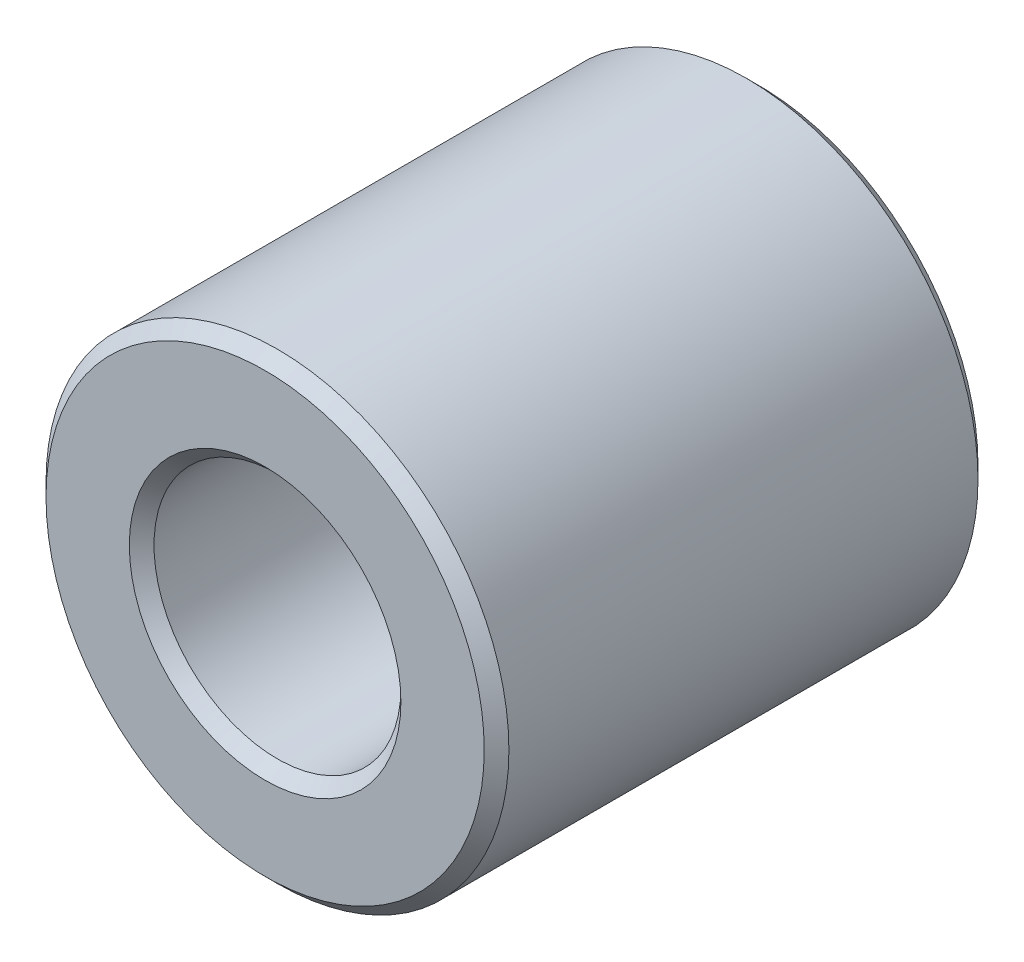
SolidWorks part; units mm, degrees
ref_plane "Front Plane" through (0, 0, 0) normal (0, 0, 1) x (1, 0, 0)
ref_plane "Top Plane" through (0, 0, 0) normal (0, 1, 0) x (1, 0, 0)
ref_plane "Right Plane" through (0, 0, 0) normal (1, 0, 0) x (0, 0, -1)
sketch "Sketch1" plane through (0, 0, 0) normal (0, 0, 1) x (1, 0, 0)
  circle A0 centre (0, 0) radius 16
  circle A1 centre (0, 0) radius 30
  dimension "D1" = 32
  dimension "D2" = 60
extrude "Boss-Extrude1" add sketch "Sketch1" along normal mid plane 64
chamfer "Chamfer1" distance 1.6 angle 45 4 edges at (16, 0, -32) (30, 0, -32) (16, 0, 32) (30, 0, 32)
